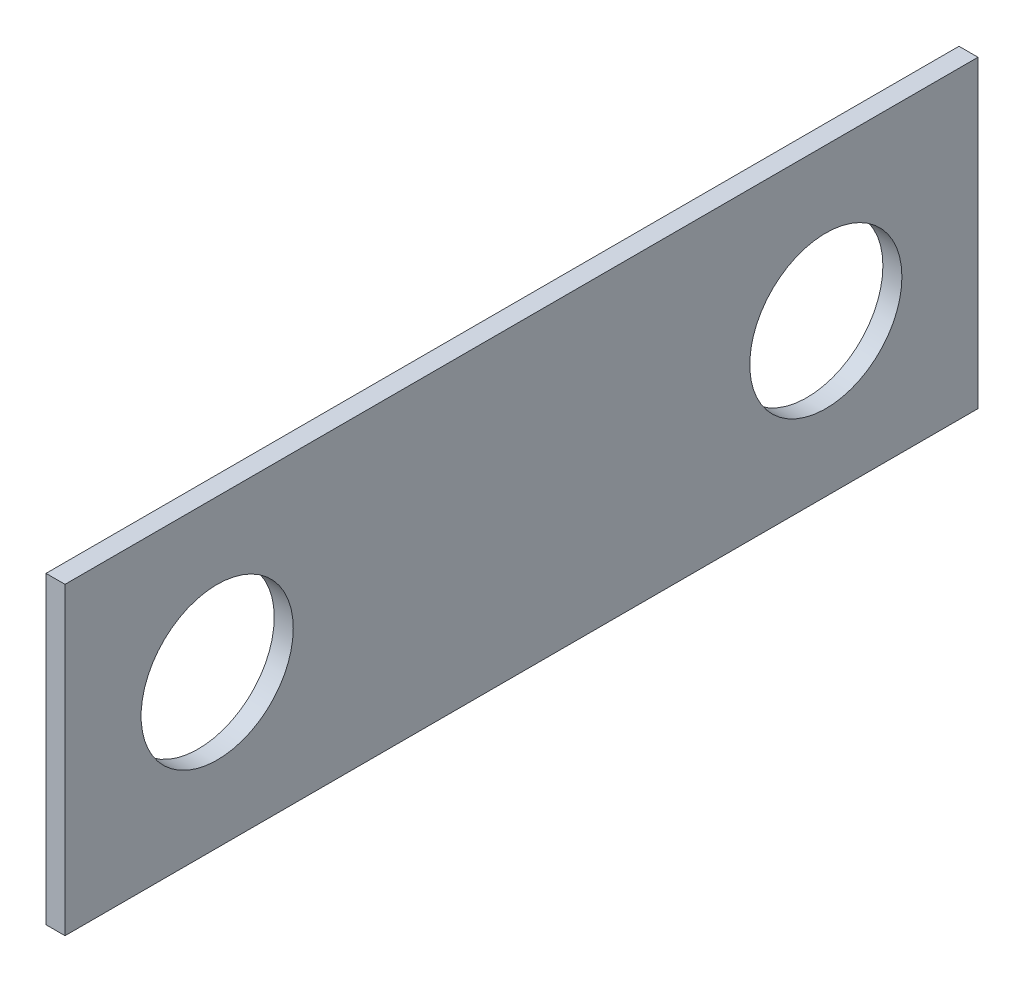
SolidWorks part; units mm, degrees
ref_plane "Front Plane" through (0, 0, 0) normal (0, 0, 1) x (1, 0, 0)
ref_plane "Top Plane" through (0, 0, 0) normal (0, 1, 0) x (1, 0, 0)
ref_plane "Right Plane" through (0, 0, 0) normal (1, 0, 0) x (0, 0, -1)
sketch "Sketch1" plane through (0, 0, 0) normal (1, 0, 0) x (0, 0, -1)
  line L0 (-12.7, 0) -> (12.7, 0) construction
  line L1 (-19.05, -6.35) -> (19.05, -6.35)
  line L2 (-19.05, -6.35) -> (-19.05, 6.35)
  line L3 (-19.05, 6.35) -> (19.05, 6.35)
  line L4 (19.05, -6.35) -> (19.05, 6.35)
  line L5 (-19.05, -6.35) -> (19.05, 6.35) construction
  line L6 (-19.05, 6.35) -> (19.05, -6.35) construction
  circle A0 centre (-12.7, 0) radius 3.175
  circle A1 centre (12.7, 0) radius 3.175
  circle A4 centre (12.7, -25.4) radius 3.175
  circle A5 centre (-12.7, -25.4) radius 3.175
  point P0 (0, 0)
  point P5 (12.6212, 12.5277)
  point P6 (0, 0)
  dimension "D5" = 2
  dimension "D7" = 6.35
  dimension "D1" = 12.7
  dimension "D2" = 25.4
  dimension "D3" = 38.1
  dimension "D6" = 2
extrude "Boss-Extrude1" add sketch "Sketch1" along normal blind 0.7937
